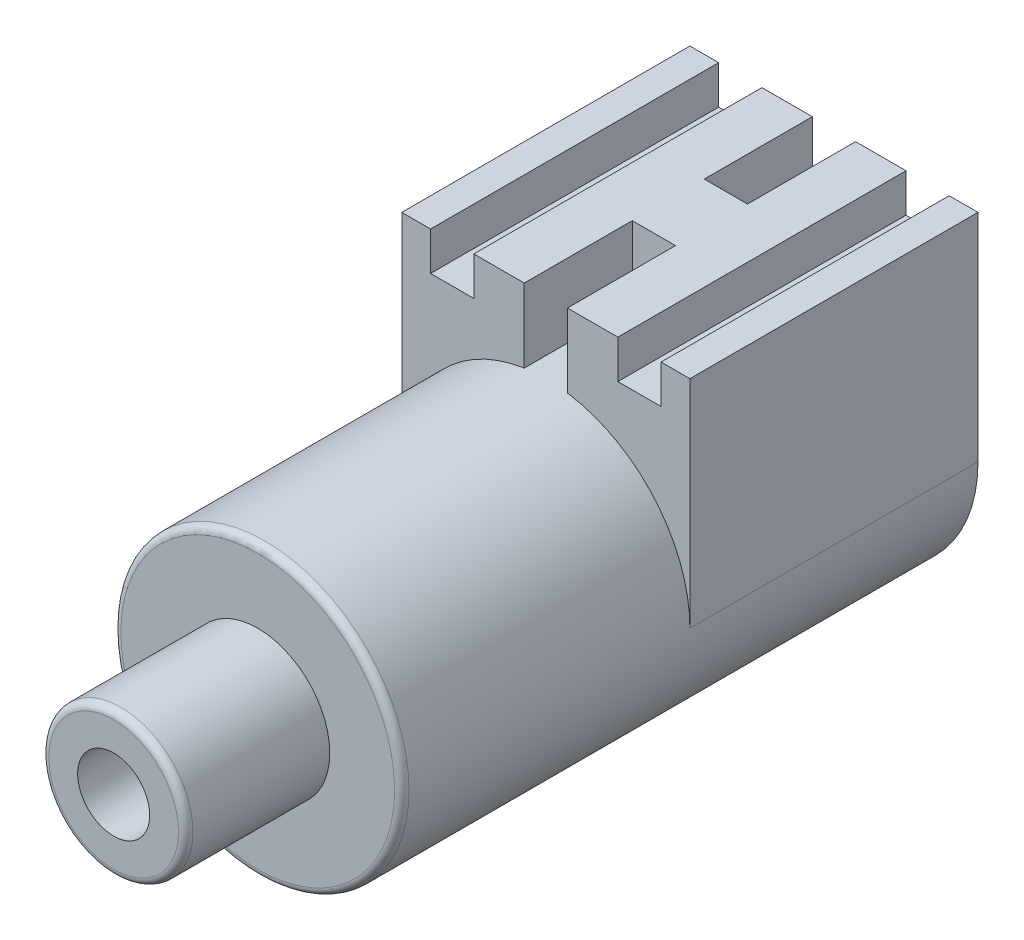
SolidWorks part; units mm, degrees
ref_plane "Face" through (0, 0, 0) normal (0, 0, 1) x (1, 0, 0)
ref_plane "Dessus" through (0, 0, 0) normal (0, 1, 0) x (1, 0, 0)
ref_plane "Droite" through (0, 0, 0) normal (1, 0, 0) x (0, 0, -1)
sketch "Esquisse1" plane through (0, 0, 0) normal (0, 0, 1) x (1, 0, 0)
  circle A0 centre (0, 0) radius 1
  dimension "D1" = 2
extrude "Extrusion1" add sketch "Esquisse1" against normal blind 2
sketch "Esquisse2" plane through (0, 0, -2) normal (0, 0, -1) x (-1, 0, 0)
  circle A0 centre (0, 0) radius 2
  dimension "D1" = 4
extrude "Extrusion2" add sketch "Esquisse2" along normal blind 8
sketch "Esquisse3" plane through (0, 0, 0) normal (0, 0, 1) x (1, 0, 0)
  circle A0 centre (0, 0) radius 0.5
  dimension "D1" = 1
extrude "Enlèv. mat.-Extru.1" cut sketch "Esquisse3" against normal through all
sketch "Esquisse4" plane through (0, 0, -10) normal (0, 0, -1) x (-1, 0, 0)
  line L1 (-2, 3) -> (2, 3)
  line L2 (-2, 3) -> (-2, 0)
  line L4 (2, 3) -> (2, 0)
  circle A0 centre (0, 0) radius 2 construction
  arc A1 (-2, 0) -> (2, 0) centre (0, 0) ccw
  dimension "D1" = 3
extrude "Extrusion4" add sketch "Esquisse4" against normal blind 4
fillet "Congé1" radius 0.1 2 edges at (1, 0, 0) (-2, 0, -2)
sketch "Esquisse5" plane through (0, 0, -10) normal (0, 0, -1) x (-1, 0, 0)
  line L0 (0, 0) -> (0, 3.1895) construction
  line L1 (2, 3) -> (-2, 3) construction
  line L2 (-1.6, 3) -> (-1, 3)
  line L3 (-1.6, 3) -> (-1.6, 2.4652)
  line L4 (-1.6, 2.4652) -> (-1, 2.4652)
  line L5 (-1, 3) -> (-1, 2.4652)
  line L7 (1, 3) -> (1.6, 3)
  line L8 (1, 3) -> (1, 2.4652)
  line L9 (1, 2.4652) -> (1.6, 2.4652)
  line L10 (1.6, 3) -> (1.6, 2.4652)
  dimension "D1" = 0.6
  dimension "D2" = 2
extrude "Enlèv. mat.-Extru.2" cut sketch "Esquisse5" against normal through all
sketch "Esquisse6" plane through (0, 0, -10) normal (0, 0, -1) x (-1, 0, 0)
  line L0 (0, 0) -> (0, 3.1806) construction
  line L1 (1, 3) -> (-1, 3) construction
  line L2 (-0.3, 3) -> (0.3, 3)
  line L3 (-0.3, 3) -> (-0.3, 1.9774)
  line L5 (0.3, 3) -> (0.3, 1.9774)
  arc A0 (2, 0) -> (-2, 0) centre (0, 0) ccw construction
  arc A1 (0.3, 1.9774) -> (-0.3, 1.9774) centre (0, 0) ccw
  dimension "D1" = 0.6
extrude "Enlèv. mat.-Extru.3" cut sketch "Esquisse6" against normal blind 1.5
sketch "Esquisse7" plane through (0, 0, -6) normal (0, 0, 1) x (1, 0, 0)
  line L0 (0.3, 3) -> (0.3, 1.9774) construction
  line L1 (-0.3, 3) -> (0.3, 3)
  line L2 (-0.3, 3) -> (-0.3, 1.9774)
  line L4 (0.3, 3) -> (0.3, 1.9774)
  circle A0 centre (0, 0) radius 2 construction
  arc A1 (0.3, 1.9774) -> (-0.3, 1.9774) centre (0, 0) ccw
extrude "Enlèv. mat.-Extru.4" cut sketch "Esquisse7" against normal blind 1.5
